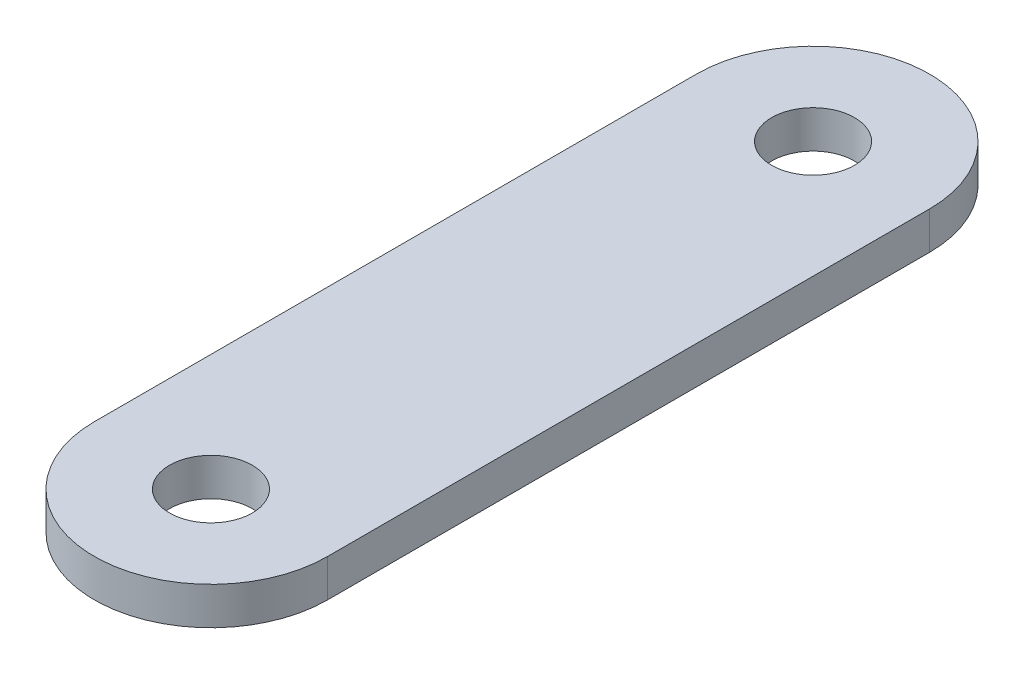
SolidWorks part; units mm, degrees
ref_plane "Front" through (0, 0, 0) normal (0, 0, 1) x (1, 0, 0)
ref_plane "Top" through (0, 0, 0) normal (0, 1, 0) x (1, 0, 0)
ref_plane "Right" through (0, 0, 0) normal (1, 0, 0) x (0, 0, -1)
sketch "Sketch1" plane through (0, 0, 0) normal (0, 1, 0) x (1, 0, 0)
  line L0 (0, 9.1) -> (-7.5377, 9.1) construction
  line L1 (-3.1, 8) -> (3.1, 8) construction
  line L2 (-3.1, 8) -> (-3.1, 0)
  line L3 (-3.1, 0) -> (3.1, 0)
  line L4 (3.1, 8) -> (3.1, 0)
  line L5 (0, 11.1) -> (-7.5377, 11.1) construction
  circle A0 centre (0, 8) radius 1.1
  arc A1 (-3.1, 8) -> (3.1, 8) centre (0, 8) cw
  point P4 (0, 0)
  dimension "D1" = 2.2
  dimension "D2" = 2
  dimension "D3" = 8
extrude "Boss-Extrude1" add sketch "Sketch1" along normal blind 1
mirror "Mirror1" about plane through (-3.1, 1, 0) normal (0, 0, -1)
